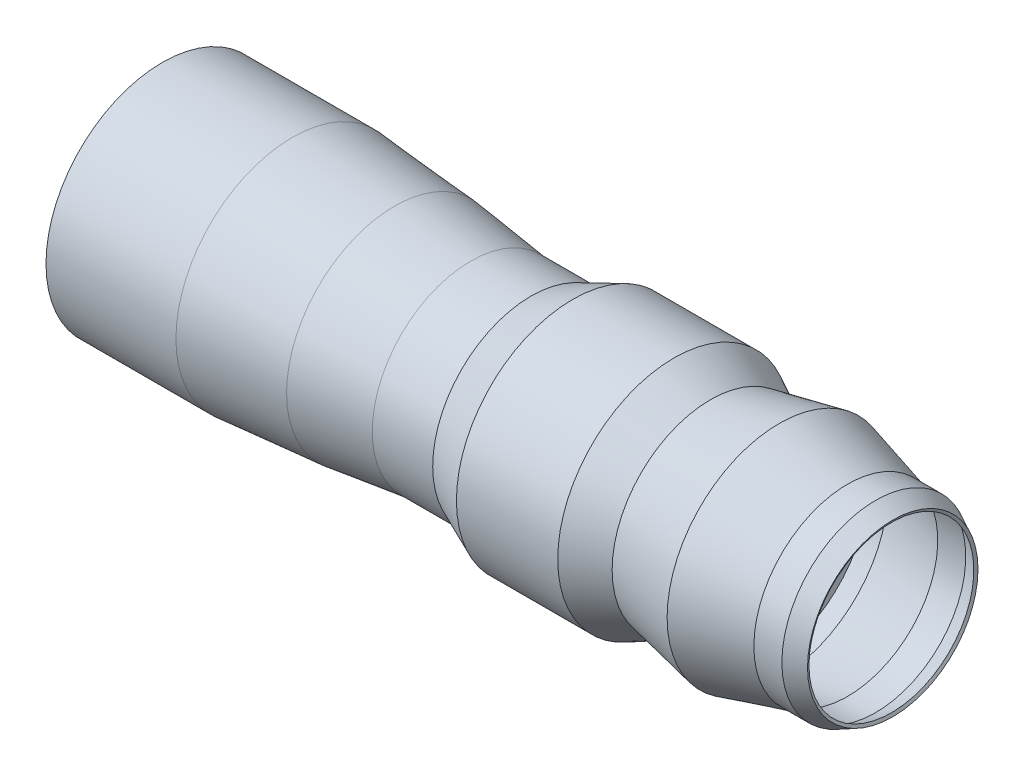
SolidWorks part; units mm, degrees
ref_plane "Front Plane" through (0, 0, 0) normal (0, 0, 1) x (1, 0, 0)
ref_plane "Top Plane" through (0, 0, 0) normal (0, 1, 0) x (1, 0, 0)
ref_plane "Right Plane" through (0, 0, 0) normal (1, 0, 0) x (0, 0, -1)
sketch "Sketch1" plane through (0, 0, 0) normal (0, 0, 1) x (1, 0, 0)
  line L0 (-311.1667, 12) -> (324.1667, 12) construction
sketch "Sketch3" plane through (0, 0, 0) normal (0, 0, 1) x (1, 0, 0)
  line L0 (-442.9556, 53.9612) -> (404.6867, 53.9612) construction
  line L1 (-442.9556, 0) -> (404.6867, 0) construction
  line L2 (-388.0448, 183.2391) -> (-243.6443, 183.2391)
  line L3 (-243.6443, 183.2391) -> (-129.9826, 173.946)
  line L4 (-129.9826, 173.946) -> (-45.3579, 163.3045)
  line L5 (-45.3579, 163.3045) -> (21.8151, 163.3045)
  line L6 (21.8151, 163.3045) -> (68.0956, 183.2391)
  line L7 (68.0956, 183.2391) -> (180.7178, 183.2391)
  line L8 (180.7178, 183.2391) -> (221.243, 163.3045)
  line L9 (221.243, 163.3045) -> (297.6355, 178.5926)
  line L10 (297.6355, 178.5926) -> (373.5398, 158.0965)
  line L11 (373.5398, 158.0965) -> (404.6867, 158.0965)
  line L12 (404.6867, 158.0965) -> (423.7959, 148.6966)
  line L13 (-388.0448, 183.2391) -> (-388.0448, 173.946)
  line L14 (-388.0448, 173.946) -> (-243.6443, 173.946)
  line L15 (-243.6443, 173.946) -> (-129.9826, 168.6253)
  line L16 (-129.9826, 168.6253) -> (-45.3579, 157.9838)
  line L17 (-45.3579, 157.9838) -> (21.8151, 157.9838)
  line L18 (21.8151, 157.9838) -> (68.0956, 177.9184)
  line L19 (68.0956, 177.9184) -> (180.7178, 177.9184)
  line L20 (180.7178, 177.9184) -> (219.1356, 159.0204)
  line L21 (219.1356, 159.0204) -> (297.6355, 174.7302)
  line L22 (297.6355, 174.7302) -> (373.5398, 154.2341)
  line L23 (373.5398, 154.2341) -> (404.6867, 154.2341)
  line L24 (404.6867, 154.2341) -> (422.2661, 145.5867)
  line L25 (422.2661, 145.5867) -> (423.7959, 148.6966)
revolve "Revolve1" add sketch "Sketch3" angle 360 about L0
sketch "Sketch4" plane through (0, 0, 0) normal (0, 0, 1) x (1, 0, 0)
  line L0 (219.1356, 159.0204) -> (180.7178, 177.9184) construction
  line L1 (180.7178, 177.9184) -> (68.0956, 177.9184) construction
  line L2 (68.0956, 177.9184) -> (21.8151, 157.9838) construction
  line L3 (219.1356, 159.0204) -> (180.7178, 177.9184)
  line L4 (180.7178, 177.9184) -> (68.0956, 177.9184)
  line L5 (68.0956, 177.9184) -> (21.8151, 157.9838)
  line L6 (21.8151, 146.9838) -> (219.1356, 146.9838) construction
  line L7 (21.8151, 163.3045) -> (21.8151, -55.3821) construction
  line L8 (219.1356, 159.0204) -> (219.1356, -51.0979) construction
  line L9 (219.1356, 146.9838) -> (-73.2849, 200.5508) construction
  line L10 (219.1356, 134.9471) -> (180.7178, 116.0492)
  line L11 (180.7178, 116.0492) -> (68.0956, 116.0492)
  line L12 (68.0956, 116.0492) -> (21.8151, 135.9838)
  dimension "D1" = 11
sketch "Sketch5" plane through (0, 0, 0) normal (0, 0, 1) x (1, 0, 0)
  line L0 (-360.2611, 53.9612) -> (-549.5093, 53.9612) construction
  line L1 (-330.5527, 177.0774) -> (-321.0656, 177.0774)
  line L2 (-330.5527, 177.0774) -> (-330.5527, 151.2362)
  line L3 (-330.5527, 151.2362) -> (-321.0656, 151.2362)
  line L4 (-321.0656, 177.0774) -> (-321.0656, 151.2362)
  line L5 (-289.8937, 177.7393) -> (-281.3101, 177.7393)
  line L6 (-289.8937, 177.7393) -> (-289.8937, 151.2362)
  line L7 (-289.8937, 151.2362) -> (-281.3101, 151.2362)
  line L8 (-281.3101, 177.7393) -> (-281.3101, 151.2362)
  line L9 (-250.5899, 178.7643) -> (-240.651, 178.7643)
  line L10 (-250.5899, 178.7643) -> (-250.5899, 151.2362)
  line L11 (-250.5899, 151.2362) -> (-240.651, 151.2362)
  line L12 (-240.651, 178.7643) -> (-240.651, 151.2362)
  line L13 (-210.6252, 174.408) -> (-199.7324, 174.408)
  line L14 (-210.6252, 174.408) -> (-210.6252, 149.0749)
  line L15 (-210.6252, 149.0749) -> (-199.7324, 149.0749)
  line L16 (-199.7324, 174.408) -> (-199.7324, 149.0749)
  line L17 (-171.1, 171.8455) -> (-160.2072, 171.8455)
  line L18 (-171.1, 171.8455) -> (-171.1, 149.0749)
  line L19 (-171.1, 149.0749) -> (-160.2072, 149.0749)
  line L20 (-160.2072, 171.8455) -> (-160.2072, 149.0749)
  line L21 (-132.2676, 170.5642) -> (-122.53, 170.5642)
  line L22 (-132.2676, 170.5642) -> (-132.2676, 149.0749)
  line L23 (-132.2676, 149.0749) -> (-122.53, 149.0749)
  line L24 (-122.53, 170.5642) -> (-122.53, 149.0749)
  line L25 (-91.5235, 165.6955) -> (-79.7359, 165.6955)
  line L26 (-91.5235, 165.6955) -> (-91.5235, 142.6767)
  line L27 (-91.5235, 142.6767) -> (-79.7359, 142.6767)
  line L28 (-79.7359, 165.6955) -> (-79.7359, 142.6767)
  line L29 (-360.2611, 9.5639) -> (-360.2611, 98.3585) construction
revolve "Revolve2" add sketch "Sketch5" angle 360 about L0
sketch "Sketch6" plane through (0, 0, 0) normal (0, 0, 1) x (1, 0, 0)
  line L0 (98.6251, 53.9612) -> (143.3813, 53.9612) construction
  line L1 (245.5666, 167.3738) -> (255.2069, 167.3738)
  line L2 (245.5666, 167.3738) -> (245.5666, 145.9209)
  line L3 (245.5666, 145.9209) -> (255.2069, 145.9209)
  line L4 (255.2069, 167.3738) -> (255.2069, 145.9209)
  line L5 (270.2782, 172.3976) -> (280.0542, 172.3976)
  line L6 (270.2782, 172.3976) -> (270.2782, 148.3649)
  line L7 (270.2782, 148.3649) -> (280.0542, 148.3649)
  line L8 (280.0542, 172.3976) -> (280.0542, 148.3649)
  line L9 (98.6251, 78.1886) -> (98.6251, 29.7339) construction
revolve "Revolve3" add sketch "Sketch6" angle 360 about L0
fillet "Fillet1" radius 10 7 edges at (-91.5235, 53.9612, -88.7154) (-132.2676, 53.9612, -95.1137) (-171.1, 53.9612, -95.1137) (-210.6252, 53.9612, -95.1137) (-250.5899, 53.9612, -97.275) (-289.8937, 53.9612, -97.275) (-330.5527, 53.9612, -97.275)
fillet "Fillet2" radius 10 2 edges at (255.2069, 53.9612, 91.9597) (280.0542, 53.9612, 94.4037)
sketch "Sketch8" plane through (0, 0, 0) normal (0, 0, 1) x (1, 0, 0)
  line L0 (21.8151, 157.9838) -> (68.0956, 177.9184)
  line L1 (68.0956, 177.9184) -> (180.7178, 177.9184)
  line L2 (180.7178, 177.9184) -> (219.1356, 159.0204)
  line L3 (21.8151, 144.4835) -> (219.1356, 144.4835) construction
  line L5 (21.8151, 163.3045) -> (21.8151, -55.3821) construction
  line L8 (219.1356, 159.0204) -> (219.1356, -51.0979) construction
  line L12 (21.8151, 157.9838) -> (219.1356, 159.0204)
revolve "Revolve4" add sketch "Sketch8" angle 360 about L3
